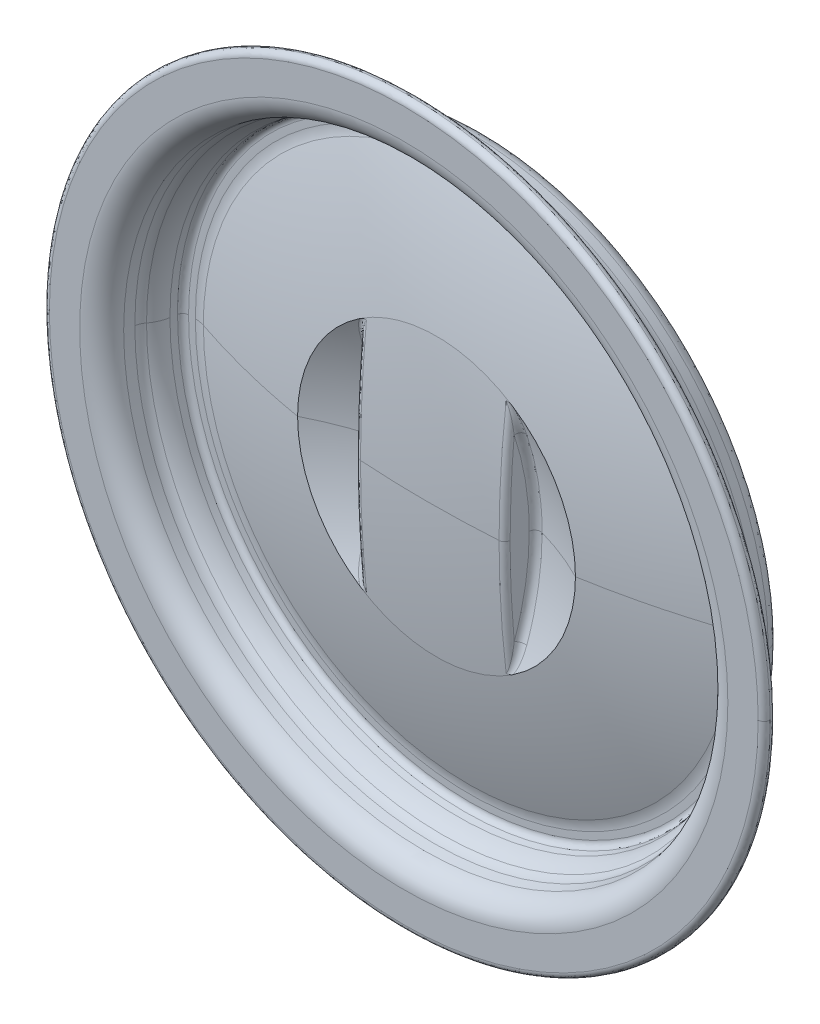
SolidWorks part; units mm, degrees
ref_plane "Plan de face" through (0, 0, 0) normal (0, 0, 1) x (1, 0, 0)
ref_plane "Plan de dessus" through (0, 0, 0) normal (0, 1, 0) x (1, 0, 0)
ref_plane "Plan de droite" through (0, 0, 0) normal (1, 0, 0) x (0, 0, -1)
imported_body "Importée3"
fillet "Congé1" radius 1
fillet "Congé2" radius 2 1 edges at (52.25, 0, -2)
fillet "Congé3" radius 3 2 edges at (5.1571, 44.2397, -13) (-5.1571, -44.2397, -13)
fillet "Congé4" radius 3 2 edges
fillet "Congé5" radius 4 1 edges at (50.5418, 0, 0)
fillet "Congé6" radius 5 2 edges at (-9.8508, 43.7803, -11) (9.8508, -43.7803, -11)
